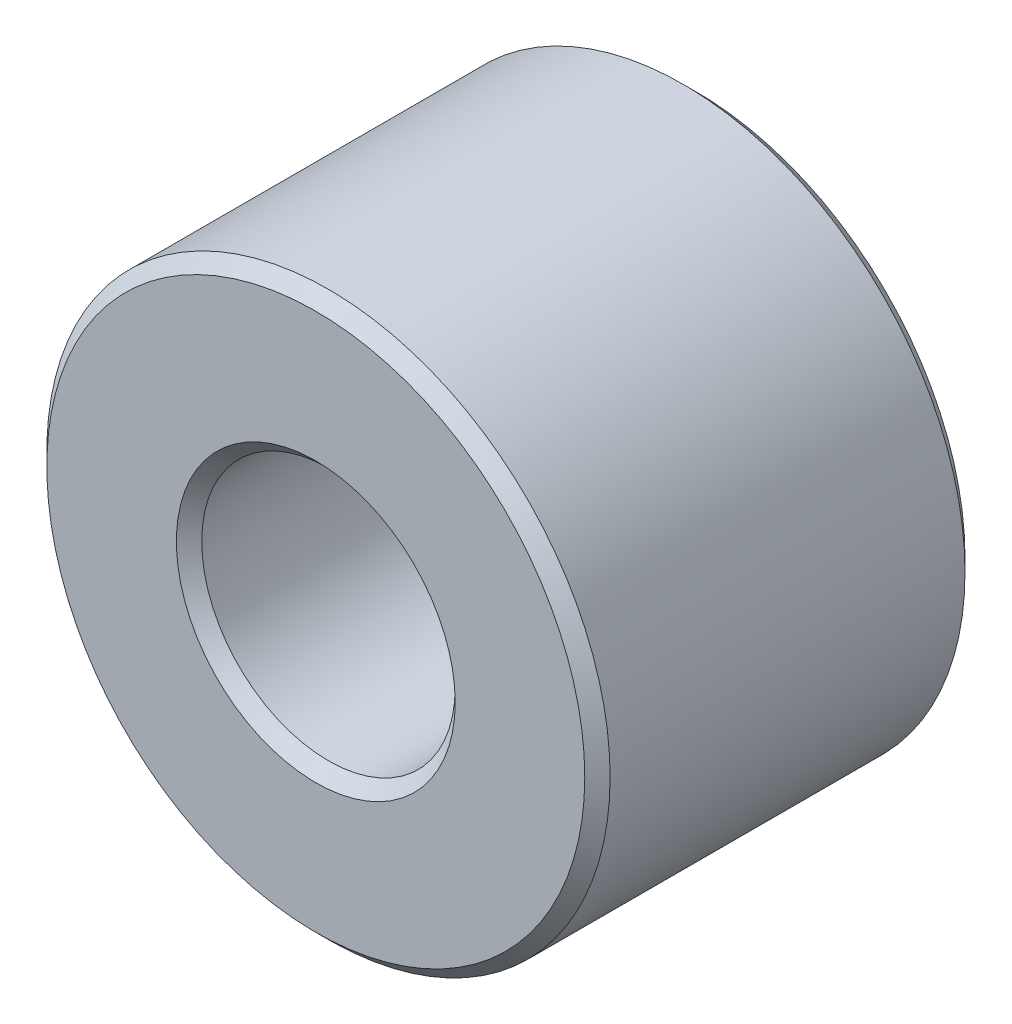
SolidWorks part; units mm, degrees
ref_plane "Front Plane" through (0, 0, 0) normal (0, 0, 1) x (1, 0, 0)
ref_plane "Top Plane" through (0, 0, 0) normal (0, 1, 0) x (1, 0, 0)
ref_plane "Right Plane" through (0, 0, 0) normal (1, 0, 0) x (0, 0, -1)
sketch "Sketch1" plane through (0, 0, 0) normal (0, 0, 1) x (1, 0, 0)
  circle A0 centre (0, 0) radius 9
  circle A1 centre (0, 0) radius 20
  dimension "D1" = 18
  dimension "D2" = 40
extrude "Boss-Extrude1" add sketch "Sketch1" along normal mid plane 27
chamfer "Chamfer1" distance 0.9 angle 45 4 edges at (9, 0, -13.5) (20, 0, -13.5) (9, 0, 13.5) (20, 0, 13.5)
